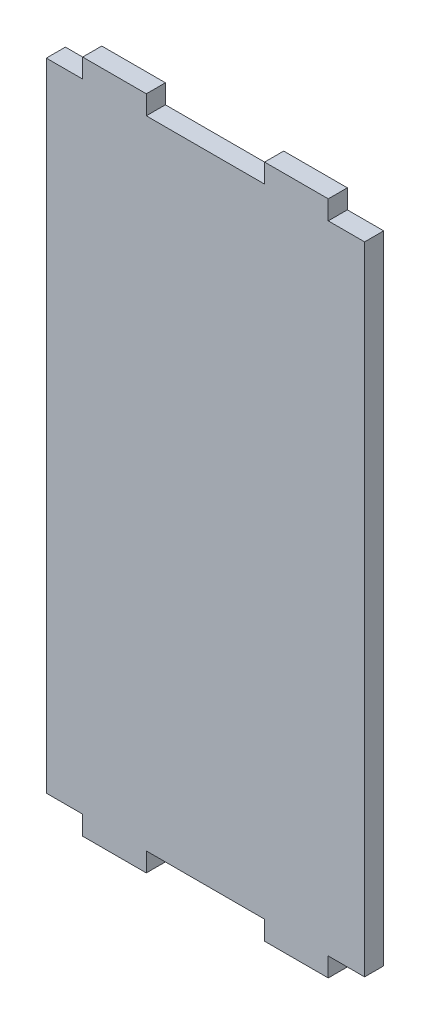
SolidWorks part; units mm, degrees
ref_plane "Plan de face" through (0, 0, 0) normal (0, 0, 1) x (1, 0, 0)
ref_plane "Plan de dessus" through (0, 0, 0) normal (0, 1, 0) x (1, 0, 0)
ref_plane "Plan de droite" through (0, 0, 0) normal (1, 0, 0) x (0, 0, -1)
sketch "Esquisse1" plane through (0, 0, 0) normal (0, 0, 1) x (1, 0, 0)
  line L0 (25, -3) -> (19.29, -3)
  line L1 (19.29, -3) -> (19.29, 0)
  line L2 (19.29, 0) -> (9.29, 0)
  line L3 (9.29, 0) -> (9.29, -3)
  line L4 (9.29, -3) -> (-9.29, -3)
  line L5 (9.29, -3) -> (-9.29, -3) construction
  line L6 (0, 0) -> (0, -116) construction
  line L7 (1.5, -116) -> (-1.5, -116) construction
  line L8 (90, -53) -> (-90, -53) construction
  line L9 (90, -3) -> (90, -103) construction
  line L10 (-90, -103) -> (-90, -3) construction
  line L11 (-9.29, 0) -> (-9.29, -3)
  line L12 (-19.29, 0) -> (-9.29, 0)
  line L13 (-19.29, -3) -> (-19.29, 0)
  line L14 (-25, -3) -> (-19.29, -3)
  line L15 (-25, -103) -> (-19.29, -103)
  line L16 (-19.29, -103) -> (-19.29, -106)
  line L17 (-19.29, -106) -> (-9.29, -106)
  line L18 (-9.29, -106) -> (-9.29, -103)
  line L19 (9.29, -103) -> (-9.29, -103)
  line L20 (9.29, -106) -> (9.29, -103)
  line L21 (19.29, -106) -> (9.29, -106)
  line L22 (19.29, -103) -> (19.29, -106)
  line L23 (25, -103) -> (19.29, -103)
  line L24 (-25, -3) -> (-25, -103)
  line L25 (25, -3) -> (25, -103)
  point P25 (0, -3)
  point P29 (0, -103)
extrude "Boss.-Extru.1" add sketch "Esquisse1" against normal blind 3
